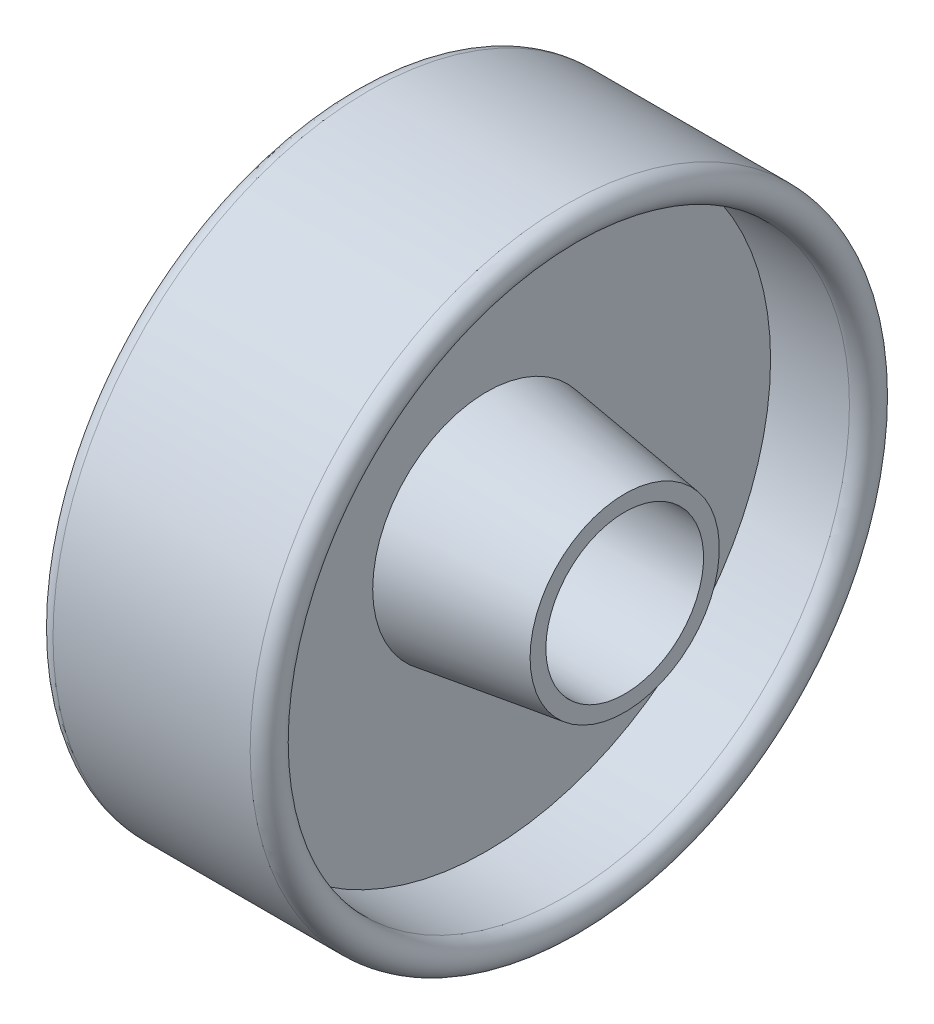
SolidWorks part; units mm, degrees
ref_plane "Front Plane" through (0, 0, 0) normal (0, 0, 1) x (1, 0, 0)
ref_plane "Top Plane" through (0, 0, 0) normal (0, 1, 0) x (1, 0, 0)
ref_plane "Right Plane" through (0, 0, 0) normal (1, 0, 0) x (0, 0, -1)
sketch "Sketch1" plane through (0, 0, 0) normal (0, 1, 0) x (1, 0, 0)
  line L0 (0, 0) -> (79.9408, 0) construction
  line L1 (0, 0) -> (0, 53.2757) construction
  line L2 (-20, 10) -> (20, 10)
  line L3 (20, 10) -> (20, 12)
  line L4 (-20, 10) -> (-20, 12)
  line L5 (20, 12) -> (2.5, 14.4595)
  line L6 (-20, 12) -> (-2.5, 14.4595)
  line L7 (2.5, 14.4595) -> (2.5, 36)
  line L8 (-2.5, 14.4595) -> (-2.5, 36)
  line L9 (2.5, 36) -> (12.5, 36)
  line L10 (-2.5, 36) -> (-12.5, 36)
  line L11 (12.5, 40) -> (-12.5, 40)
  arc A0 (12.5, 36) -> (12.5, 40) centre (12.5, 38) ccw
  arc A1 (-12.5, 36) -> (-12.5, 40) centre (-12.5, 38) cw
  point P7 (0, 10)
  point P17 (0, 40)
  dimension "D8" = 29
  dimension "D1" = 24
  dimension "D2" = 4
  dimension "D3" = 5
  dimension "D4" = 8
  dimension "D5" = 40
  dimension "D6" = 80
  dimension "D7" = 20
revolve "Revolve1" add sketch "Sketch1" angle 360 about L0
sketch "Sketch2" plane through (-2.5, 0, 0) normal (-1, 0, 0) x (0, 0, 1)
  line L0 (0, 0) -> (0, 30) construction
  line L1 (0, 0) -> (19.2836, 22.9813) construction
  line L2 (0, 0) -> (24.1922, 0) construction
  line L3 (0, 0) -> (25.9808, -15) construction
  arc A0 (-19.2836, 22.9813) -> (19.2836, 22.9813) centre (0, 0) cw construction
  arc A1 (-25.9808, -15) -> (25.9808, -15) centre (0, 0) ccw construction
  text T0 "Designed using" font "Courier New" height in points 11
  text T1 "SolidWorks" font "Arial Rounded MT Bold" height in points 20
  dimension "D2" = 30
  dimension "D1" = 40
  dimension "D3" = 30
extrude "Boss-Extrude1" add sketch "Sketch2" along normal blind 1 draft 1
